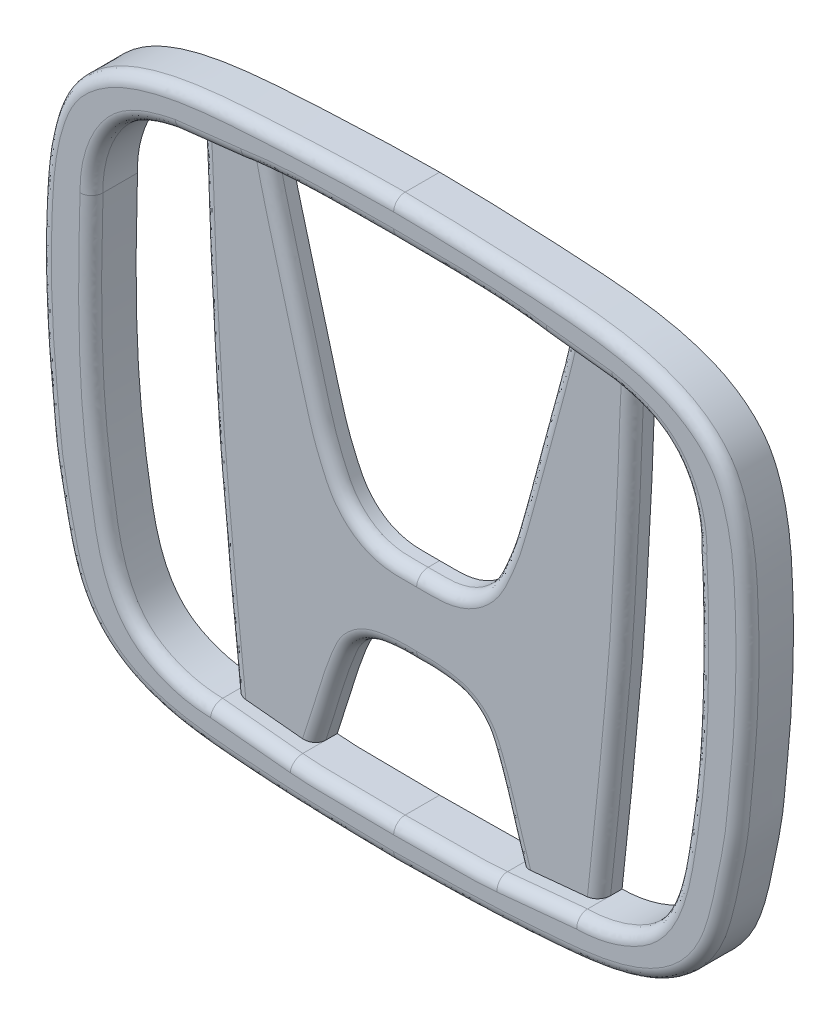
SolidWorks part; units mm, degrees
ref_plane "Спереди" through (0, 0, 0) normal (0, 0, 1) x (1, 0, 0)
ref_plane "Сверху" through (0, 0, 0) normal (0, 1, 0) x (1, 0, 0)
ref_plane "Справа" through (0, 0, 0) normal (1, 0, 0) x (0, 0, -1)
sketch "Эскиз1" plane through (0, 0, 0) normal (0, 0, 1) x (1, 0, 0)
  line L0 (16.6688, 23.0961) -> (76.6688, 23.0961) construction
  line L1 (16.0893, 23.9522) -> (16.0904, 23.9522) construction
  line L10 (76.6931, 23.9522) -> (76.6941, 23.9522) construction
  spline S0 degree 3 poles (46.3917, 5.8852) (48.0499, 5.883) (50.5388, 5.9452) (53.0627, 5.9364) (54.3783, 5.9947) (54.9043, 6.0369) (55.3008, 6.0732) knots 0 0 0 0 0.567161 0.826425 0.869066 1 1 1 1
  spline S1 degree 3 poles (55.3008, 6.0732) (55.051, 6.8383) (54.6301, 8.0756) (54.1036, 9.892) (53.5403, 11.6716) (52.9387, 13.3599) (52.3336, 14.7731) (51.536, 15.6614) (50.5656, 16.2861) (48.7796, 16.7182) (47.39, 16.7587) (46.3917, 16.7218) knots 0 0 0 0 0.153792 0.249595 0.361357 0.510083 0.593168 0.651934 0.735706 0.809105 1 1 1 1
  spline S2 degree 3 poles (46.3917, 23.5602) (47.1379, 23.591) (48.2573, 23.4937) (49.7455, 23.772) (50.8324, 24.2146) (51.8463, 24.9551) (52.903, 26.1181) (53.6477, 27.7582) (54.4109, 29.6081) (55.0968, 31.953) (56.0138, 35.3039) (57.5506, 41.1272) (58.8883, 45.8256) (59.5681, 48.9672) knots 0 0 0 0 0.072116 0.106987 0.144912 0.184119 0.226993 0.294714 0.355786 0.420011 0.529634 0.690555 1 1 1 1
  spline S3 degree 3 poles (46.3917, 49.5756) (50.7861, 49.5074) (55.207, 49.6359) (59.5681, 48.9672) knots 0 0 0 0 1 1 1 1
  spline S4 degree 3 poles (65.267, 48.3124) (66.8387, 48.0061) (71.215, 46.8035) (72.7631, 42.0558) (72.6376, 39.6332) knots 0 0 0 0 0.395579 1 1 1 1
  spline S5 degree 3 poles (72.6376, 39.6332) (72.773, 37.3399) (72.8338, 33.8855) (72.7884, 29.2292) (72.6675, 25.8336) (72.3608, 21.6362) (71.7341, 17.1582) (71.0116, 13.1127) (69.8377, 10.4793) (68.5159, 8.7408) (65.8973, 7.2142) (63.6917, 6.7653) (62.2715, 6.7473) knots 0 0 0 0 0.180244 0.271013 0.365374 0.446859 0.601008 0.720901 0.766608 0.826452 0.888723 1 1 1 1
  spline S6 degree 3 poles (62.2715, 6.7473) (62.3608, 7.5954) (62.5352, 9.3829) (62.8519, 12.2869) (63.186, 15.3319) (63.4415, 18.4356) (63.7853, 21.7536) (64.1858, 26.1819) (64.5048, 32.0407) (64.95, 39.6661) (65.0812, 45.1991) (65.267, 48.3124) knots 0 0 0 0 0.061376 0.129249 0.210232 0.281824 0.353348 0.450298 0.601783 0.775564 1 1 1 1
  spline S7 degree 3 poles (46.3917, 52.8377) (48.9698, 52.8303) (53.1378, 52.6914) (58.8271, 52.4043) (63.6224, 52.0594) (67.8734, 51.3326) (71.8957, 49.7998) (74.964, 47.3524) (76.3443, 43.7479) (76.9403, 40.5021) (77.1334, 36.9266) (77.232, 33.3578) (77.1083, 29.5828) (76.9154, 26.0121) (76.5327, 22.4756) (76.2773, 19.158) (75.6056, 15.9437) (74.9816, 12.757) (73.9405, 9.45) (71.77, 6.5382) (68.2563, 4.4538) (64.2736, 3.5353) (59.7393, 3.1299) (53.8668, 2.7366) (49.2479, 2.6883) (46.3917, 2.6345) knots 0 0 0 0 0.079322 0.128333 0.175266 0.227357 0.260159 0.307504 0.342276 0.376401 0.409011 0.452285 0.486266 0.525206 0.562289 0.595744 0.627469 0.663185 0.69578 0.733367 0.771939 0.818947 0.857906 0.91208 1 1 1 1
  spline S8 degree 3 poles (27.5165, 48.3124) (25.9456, 48.006) (21.5613, 46.8032) (20.0258, 42.0458) (20.0951, 39.6332) knots 0 0 0 0 0.395232 1 1 1 1
  spline S9 degree 3 poles (30.512, 6.7473) (30.4226, 7.5954) (30.2483, 9.3829) (29.9316, 12.2869) (29.5975, 15.3319) (29.342, 18.4356) (28.9982, 21.7536) (28.5977, 26.1819) (28.2786, 32.0407) (27.8334, 39.6661) (27.7023, 45.1991) (27.5165, 48.3124) knots 0 0 0 0 0.061376 0.129249 0.210232 0.281824 0.353348 0.450298 0.601783 0.775564 1 1 1 1
  spline S10 degree 3 poles (20.0951, 39.6332) (20.04, 37.3376) (19.9429, 33.8851) (19.9964, 29.2292) (20.1156, 25.8336) (20.4228, 21.6362) (21.0493, 17.1582) (21.7718, 13.1127) (22.9458, 10.4793) (24.2676, 8.7408) (26.8861, 7.2142) (29.0918, 6.7653) (30.512, 6.7473) knots 0 0 0 0 0.180206 0.270979 0.365345 0.446833 0.600989 0.720888 0.766597 0.826443 0.888718 1 1 1 1
  spline S11 degree 3 poles (46.3917, 5.8852) (44.7335, 5.883) (42.2446, 5.9452) (39.7208, 5.9364) (38.4051, 5.9947) (37.8791, 6.0369) (37.4827, 6.0732) knots 0 0 0 0 0.567161 0.826425 0.869066 1 1 1 1
  spline S12 degree 3 poles (37.4827, 6.0732) (37.7324, 6.8383) (38.1534, 8.0756) (38.6798, 9.892) (39.2432, 11.6716) (39.8447, 13.3599) (40.4498, 14.7731) (41.2474, 15.6614) (42.2178, 16.2861) (44.0039, 16.7182) (45.3934, 16.7587) (46.3917, 16.7218) knots 0 0 0 0 0.153792 0.249595 0.361357 0.510083 0.593168 0.651934 0.735706 0.809105 1 1 1 1
  spline S13 degree 3 poles (46.3917, 23.5602) (45.6455, 23.591) (44.5262, 23.4937) (43.038, 23.772) (41.951, 24.2146) (40.9371, 24.9551) (39.8804, 26.1181) (39.1358, 27.7582) (38.3726, 29.6081) (37.6867, 31.953) (36.7696, 35.3039) (35.2329, 41.1272) (33.8951, 45.8256) (33.2153, 48.9672) knots 0 0 0 0 0.072116 0.106987 0.144912 0.184119 0.226993 0.294714 0.355786 0.420011 0.529634 0.690555 1 1 1 1
  spline S14 degree 3 poles (46.3917, 49.5756) (41.9973, 49.5074) (37.5764, 49.6359) (33.2153, 48.9672) knots 0 0 0 0 1 1 1 1
  spline S15 degree 3 poles (46.3917, 52.8377) (43.8137, 52.8303) (39.6457, 52.6914) (33.9564, 52.4043) (29.1611, 52.0594) (24.91, 51.3326) (20.8878, 49.7998) (17.8194, 47.3524) (16.4392, 43.7479) (15.8431, 40.5021) (15.6501, 36.9266) (15.5515, 33.3578) (15.6752, 29.5828) (15.8681, 26.0121) (16.2508, 22.4756) (16.5061, 19.158) (17.1779, 15.9437) (17.8018, 12.757) (18.8429, 9.45) (21.0135, 6.5382) (24.5272, 4.4538) (28.5098, 3.5353) (33.0441, 3.1299) (38.9166, 2.7366) (43.5356, 2.6883) (46.3917, 2.6345) knots 0 0 0 0 0.079322 0.128333 0.175266 0.227357 0.260159 0.307504 0.342276 0.376401 0.409011 0.452285 0.486266 0.525206 0.562289 0.595744 0.627469 0.663185 0.69578 0.733367 0.771939 0.818947 0.857906 0.91208 1 1 1 1
  spline S16 degree 1 poles (30.512, 6.7473) (37.4827, 6.0732) knots 0 0 1 1
  spline S17 degree 1 poles (55.3008, 6.0732) (62.2715, 6.7473) knots 0 0 1 1
  spline S18 degree 1 poles (59.5681, 48.9672) (65.267, 48.3124) knots 0 0 1 1
  spline S19 degree 1 poles (27.5165, 48.3124) (33.2153, 48.9672) knots 0 0 1 1
  dimension "D1" = 60
extrude "Бобышка-Вытянуть11" add sketch "Эскиз1" along normal blind 2 contours S7 S15 S8 S19 S14 S3 S18 S4 S5 S17 S0 S11 S16 S10 | S19 S9 S16 S12 S1 S17 S6 S18 S2 S13
sketch "Эскиз5" plane through (0, 0, 2) normal (0, 0, 1) x (1, 0, 0)
  line L0 (59.5681, 48.9672) -> (65.267, 48.3124)
  line L1 (62.2715, 6.7473) -> (55.3008, 6.0732)
  line L2 (37.4827, 6.0732) -> (30.512, 6.7473)
  line L3 (27.5165, 48.3124) -> (33.2153, 48.9672)
  spline S1 degree 3 poles (-2921.2005, 57.8367) (13.9247, 205.7293) (73.6534, 117.8638) (72.7884, 29.2292) (72.6675, 25.8336) (72.3608, 21.6362) (71.7341, 17.1582) (71.0116, 13.1127) (69.8377, 10.4793) (68.5159, 8.7408) (26.662, -15.6597) (-130.1326, 267.3263) (3021.9607, 419.2568) knots -6.58977 -6.58977 -6.58977 -6.58977 0.180244 0.271013 0.365374 0.446859 0.601008 0.720901 0.766608 0.826452 0.888723 4.496992 4.496992 4.496992 4.496992 only from (72.6376, 39.6332) to (62.2715, 6.7473) construction
  spline S2 degree 3 poles (-37.1996, -3989.3051) (-135.491, 100.5949) (-36.3596, -3.3063) (59.7393, 3.1299) (64.2736, 3.5353) (68.2563, 4.4538) (71.77, 6.5382) (73.9405, 9.45) (74.9816, 12.757) (75.6056, 15.9437) (76.2773, 19.158) (76.5327, 22.4756) (76.9154, 26.0121) (77.1083, 29.5828) (77.232, 33.3578) (77.1334, 36.9266) (76.9403, 40.5021) (76.3443, 43.7479) (74.964, 47.3524) (71.8957, 49.7998) (67.8734, 51.3326) (63.6224, 52.0594) (58.8271, 52.4043) (-52.7818, 58.037) (-164.3481, 13.806) (-354.7388, -3917.4771) knots -2.781747 -2.781747 -2.781747 -2.781747 0.08792 0.142094 0.181053 0.228061 0.266633 0.30422 0.336815 0.372531 0.404256 0.437711 0.474794 0.513734 0.547715 0.590989 0.623599 0.657724 0.692496 0.739841 0.772643 0.824734 0.871667 0.920678 4.262976 4.262976 4.262976 4.262976 only from (46.3917, 2.6345) to (46.3917, 52.8377)
  spline S3 degree 3 poles (447.5265, -3917.565) (257.1332, 13.8053) (145.5661, 58.0371) (33.9564, 52.4043) (29.1611, 52.0594) (24.91, 51.3326) (20.8878, 49.7998) (17.8194, 47.3524) (16.4392, 43.7479) (15.8431, 40.5021) (15.6501, 36.9266) (15.5515, 33.3578) (15.6752, 29.5828) (15.8681, 26.0121) (16.2508, 22.4756) (16.5061, 19.158) (17.1779, 15.9437) (17.8018, 12.757) (18.8429, 9.45) (21.0135, 6.5382) (24.5272, 4.4538) (28.5098, 3.5353) (33.0441, 3.1299) (129.1432, -3.3063) (228.2749, 100.5953) (129.9824, -3989.3316) knots -3.263001 -3.263001 -3.263001 -3.263001 0.079322 0.128333 0.175266 0.227357 0.260159 0.307504 0.342276 0.376401 0.409011 0.452285 0.486266 0.525206 0.562289 0.595744 0.627469 0.663185 0.69578 0.733367 0.771939 0.818947 0.857906 0.91208 3.781754 3.781754 3.781754 3.781754 only from (46.3917, 52.8377) to (46.3917, 2.6345)
  spline S4 degree 3 poles (46.3917, 2.6345) (49.2479, 2.6883) (53.8668, 2.7366) (59.7393, 3.1299) (64.2736, 3.5353) (68.2563, 4.4538) (71.77, 6.5382) (73.9405, 9.45) (74.9816, 12.757) (75.6056, 15.9437) (76.2773, 19.158) (76.5327, 22.4756) (76.9154, 26.0121) (77.1083, 29.5828) (77.232, 33.3578) (77.1334, 36.9266) (76.9403, 40.5021) (76.3443, 43.7479) (74.964, 47.3524) (71.8957, 49.7998) (67.8734, 51.3326) (63.6224, 52.0594) (58.8271, 52.4043) (53.1378, 52.6914) (48.9698, 52.8303) (46.3917, 52.8377) knots 0 0 0 0 0.08792 0.142094 0.181053 0.228061 0.266633 0.30422 0.336815 0.372531 0.404256 0.437711 0.474794 0.513734 0.547715 0.590989 0.623599 0.657724 0.692496 0.739841 0.772643 0.824734 0.871667 0.920678 1 1 1 1
  spline S5 degree 3 poles (46.3917, 52.8377) (43.8137, 52.8303) (39.6457, 52.6914) (33.9564, 52.4043) (29.1611, 52.0594) (24.91, 51.3326) (20.8878, 49.7998) (17.8194, 47.3524) (16.4392, 43.7479) (15.8431, 40.5021) (15.6501, 36.9266) (15.5515, 33.3578) (15.6752, 29.5828) (15.8681, 26.0121) (16.2508, 22.4756) (16.5061, 19.158) (17.1779, 15.9437) (17.8018, 12.757) (18.8429, 9.45) (21.0135, 6.5382) (24.5272, 4.4538) (28.5098, 3.5353) (33.0441, 3.1299) (38.9166, 2.7366) (43.5356, 2.6883) (46.3917, 2.6345) knots 0 0 0 0 0.079322 0.128333 0.175266 0.227357 0.260159 0.307504 0.342276 0.376401 0.409011 0.452285 0.486266 0.525206 0.562289 0.595744 0.627469 0.663185 0.69578 0.733367 0.771939 0.818947 0.857906 0.91208 1 1 1 1
  spline S6 degree 3 poles (2264.524, 2024.2035) (-86.1989, -24.5111) (2.7808, 6.1103) (53.0627, 5.9364) (85.6477, 7.3797) (111.6963, 77.3015) (406.7481, -2972.3732) knots -16.445054 -16.445054 -16.445054 -16.445054 0.567161 0.826425 0.869066 11.287522 11.287522 11.287522 11.287522 only from (46.3917, 5.8852) to (55.3008, 6.0732) construction
  spline S7 degree 3 poles (-2171.7406, 2024.2035) (178.9823, -24.5111) (90.0027, 6.1103) (39.7208, 5.9364) (7.1358, 7.3797) (-18.9129, 77.3015) (-313.9646, -2972.3732) knots -16.445054 -16.445054 -16.445054 -16.445054 0.567161 0.826425 0.869066 11.287522 11.287522 11.287522 11.287522 only from (46.3917, 5.8852) to (37.4827, 6.0732) construction
  spline S8 degree 3 poles (-2965.147, 272.3748) (97.872, 196.7966) (19.0244, 113.8482) (19.9964, 29.2292) (20.1156, 25.8336) (20.4228, 21.6362) (21.0493, 17.1582) (21.7718, 13.1127) (22.9458, 10.4793) (24.2676, 8.7408) (66.121, -15.6594) (222.9124, 267.3194) (-2929.0703, 419.2515) knots -6.274607 -6.274607 -6.274607 -6.274607 0.180206 0.270979 0.365345 0.446833 0.600989 0.720888 0.766597 0.826443 0.888718 4.49711 4.49711 4.49711 4.49711 only from (20.0951, 39.6332) to (30.512, 6.7473) construction
  spline S9 degree 3 poles (-2568.6205, 1551.4363) (197.5657, -81.062) (-128.9649, 229.6925) (142.2717, -205.3988) (364.852, 3016.6438) knots -6.37362 -6.37362 -6.37362 -6.37362 0.395232 8.111664 8.111664 8.111664 8.111664 only from (27.5165, 48.3124) to (20.0951, 39.6332) construction
  spline S10 degree 3 poles (-31.5804, 3045.1725) (369.4991, -2944.7109) (-278.0503, 3044.141) (107.3904, -2947.0594) knots -14.244557 -14.244557 -14.244557 -14.244557 14.641992 14.641992 14.641992 14.641992 only from (46.3917, 49.5756) to (33.2153, 48.9672) construction
  spline S11 degree 3 poles (124.3638, 3045.1725) (-276.7156, -2944.7109) (370.8338, 3044.141) (-14.607, -2947.0594) knots -14.244557 -14.244557 -14.244557 -14.244557 14.641992 14.641992 14.641992 14.641992 only from (46.3917, 49.5756) to (59.5681, 48.9672) construction
  spline S12 degree 3 poles (2657.469, 1558.0514) (-104.7929, -81.5927) (221.3797, 230.1471) (-48.7848, -205.6257) (-420.2943, 2995.2607) knots -6.394895 -6.394895 -6.394895 -6.394895 0.395579 8.125858 8.125858 8.125858 8.125858 only from (65.267, 48.3124) to (72.6376, 39.6332) construction
  spline S13 degree 3 poles (46.3917, 5.8852) (48.0499, 5.883) (50.5388, 5.9452) (53.0627, 5.9364) (54.3783, 5.9947) (54.9043, 6.0369) (55.3008, 6.0732) knots 0 0 0 0 0.567161 0.826425 0.869066 1 1 1 1
  spline S14 degree 3 poles (46.3917, 5.8852) (44.7335, 5.883) (42.2446, 5.9452) (39.7208, 5.9364) (38.4051, 5.9947) (37.8791, 6.0369) (37.4827, 6.0732) knots 0 0 0 0 0.567161 0.826425 0.869066 1 1 1 1
  spline S15 degree 3 poles (20.0951, 39.6332) (20.04, 37.3376) (19.9429, 33.8851) (19.9964, 29.2292) (20.1156, 25.8336) (20.4228, 21.6362) (21.0493, 17.1582) (21.7718, 13.1127) (22.9458, 10.4793) (24.2676, 8.7408) (26.8861, 7.2142) (29.0918, 6.7653) (30.512, 6.7473) knots 0 0 0 0 0.180206 0.270979 0.365345 0.446833 0.600989 0.720888 0.766597 0.826443 0.888718 1 1 1 1
  spline S16 degree 3 poles (27.5165, 48.3124) (25.9456, 48.006) (21.5613, 46.8032) (20.0258, 42.0458) (20.0951, 39.6332) knots 0 0 0 0 0.395232 1 1 1 1
  spline S17 degree 3 poles (46.3917, 49.5756) (41.9973, 49.5074) (37.5764, 49.6359) (33.2153, 48.9672) knots 0 0 0 0 1 1 1 1
  spline S18 degree 3 poles (72.6376, 39.6332) (72.773, 37.3399) (72.8338, 33.8855) (72.7884, 29.2292) (72.6675, 25.8336) (72.3608, 21.6362) (71.7341, 17.1582) (71.0116, 13.1127) (69.8377, 10.4793) (68.5159, 8.7408) (65.8973, 7.2142) (63.6917, 6.7653) (62.2715, 6.7473) knots 0 0 0 0 0.180244 0.271013 0.365374 0.446859 0.601008 0.720901 0.766608 0.826452 0.888723 1 1 1 1
  spline S19 degree 3 poles (46.3917, 49.5756) (50.7861, 49.5074) (55.207, 49.6359) (59.5681, 48.9672) knots 0 0 0 0 1 1 1 1
  spline S20 degree 3 poles (65.267, 48.3124) (66.8387, 48.0061) (71.215, 46.8035) (72.7631, 42.0558) (72.6376, 39.6332) knots 0 0 0 0 0.395579 1 1 1 1
  dimension "D1" = 0
extrude "Бобышка-Вытянуть12" add sketch "Эскиз5" along normal blind 2 contours S4 S5 | L3 S17 S19 L0 S20 S18 L1 S13 S14 L2 S15 S16
fillet "Скругление3" radius 1 14 edges at (33.9973, 6.4102, 4) (58.7861, 6.4102, 4) (62.4175, 48.6398, 4) (30.3659, 48.6398, 4)
fillet "Скругление5" radius 1 6 edges
